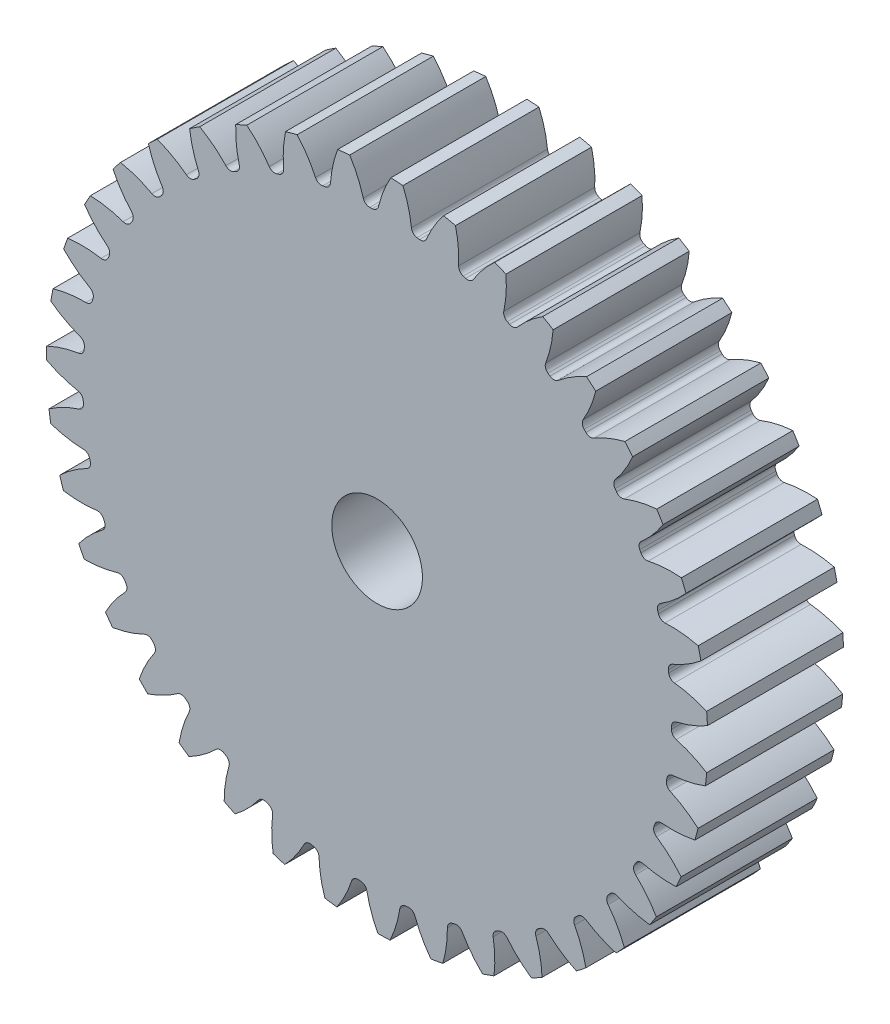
SolidWorks part; units mm, degrees
ref_plane "Front" through (0, 0, 0) normal (0, 0, 1) x (1, 0, 0)
ref_plane "Top" through (0, 0, 0) normal (0, 1, 0) x (1, 0, 0)
ref_plane "Right" through (0, 0, 0) normal (1, 0, 0) x (0, 0, -1)
sketch "Sketch3" plane through (0, 0, 0) normal (0, 0, 1) x (1, 0, 0)
  circle A0 centre (0, 0) radius 231.4222
  dimension "od" = 462.8444
extrude "gearBody" add sketch "Sketch3" along normal blind 95.25
sketch "Sketch2" plane through (0, 0, 0) normal (0, 0, 1) x (1, 0, 0)
  line L0 (0, 0) -> (191.1116, 79.161) construction
  line L1 (230.8556, -19.0237) -> (0, 0) construction
  line L2 (0, 0) -> (36.3143, 0) construction
  line L3 (220.0866, 4.5366) -> (219.7418, -13.1231) construction
  line L5 (219.9142, -4.2933) -> (0, 0) construction
  line L7 (0, 0) -> (206.8577, 0) construction
  arc A0 (206.8566, 0.6725) -> (206.6727, -8.7456) centre (0, 0) ccw construction
  arc A1 (231.2114, 9.8764) -> (230.6497, -18.8931) centre (0, 0) ccw construction
  arc A2 (220.0866, 4.5366) -> (219.7418, -13.1231) centre (0, 0) ccw construction
  arc A3 (205.964, -4.899) -> (205.9982, -3.1435) centre (0, 0) ccw
  arc A4 (230.8556, -19.0237) -> (209.3261, -9.4348) centre (187.8763, -86.5598) ccw
  arc A5 (230.8556, -19.0237) -> (231.4222, 9.9988) centre (0, 0) ccw
  arc A6 (231.4222, 9.9988) -> (209.5349, 1.2576) centre (191.1116, 79.161) cw
  arc A7 (205.9982, -3.1435) -> (209.5349, 1.2576) centre (210.5923, -3.2136) cw
  arc A8 (209.3261, -9.4348) -> (205.964, -4.899) centre (210.5572, -5.0083) cw
  point P6 (231.4222, 9.9988)
  point P22 (230.8556, -19.0237)
  dimension "baseDia" = 413.7153
  dimension "od" = 462.8444
  dimension "pd" = 440.2667
  dimension "rd" = 412.0444
  dimension "rFillet" = 4.5946
  dimension "pointX" = 231.4222
  dimension "pointY" = 9.9988
  dimension "CTT" = 17.6597
  dimension "flankCenterAngle" = 22.5
extrude "toothCut" cut sketch "Sketch2" along normal through all
pattern_circular "CirPattern1" count 39 over 360 about axis through (0, 0, 0) along (0, 0, 1) of "toothCut"
sketch "hub1Dia" plane through (0, 0, 0) normal (0, 0, -1) x (-1, 0, 0)
  circle A0 centre (0, 0) radius 12.7
  dimension "hub1Dia" = 25.4
sketch "hub2Dia" plane through (0, 0, 95.25) normal (0, 0, 1) x (1, 0, 0)
  circle A0 centre (0, 0) radius 12.7
  dimension "hub2dia" = 25.4
sketch "boreDia" plane through (0, 0, 0) normal (0, 0, 1) x (1, 0, 0)
  circle A0 centre (0, 0) radius 31.75
  dimension "boreDia" = 63.5
extrude "bore" cut sketch "boreDia" against normal mid plane 25400
